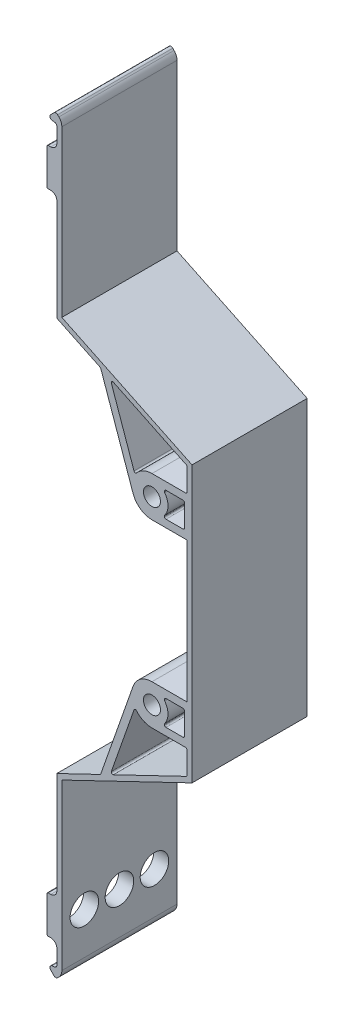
SolidWorks part; units mm, degrees
ref_plane "前视基准面" through (0, 0, 0) normal (0, 0, 1) x (1, 0, 0)
ref_plane "上视基准面" through (0, 0, 0) normal (0, 1, 0) x (1, 0, 0)
ref_plane "右视基准面" through (0, 0, 0) normal (1, 0, 0) x (0, 0, -1)
other "Configuration Table"
sketch "草图1" plane through (0, 0, 0) normal (0, 0, 1) x (1, 0, 0)
  line L2 (95, -72.9584) -> (95, -33.624) construction
  line L4 (95, -72.9584) -> (95, -40)
  line L6 (121, 27.5) -> (95, 40) construction
  line L7 (121, -21.5) -> (121, 21.5)
  line L8 (95, 33.624) -> (95, 72.9584) construction
  line L9 (95, 40) -> (95, 72.9584)
  line L10 (121, -21.5) -> (121, 21.5) construction
  line L11 (94.5667, -39.0987) -> (120, -26.8712)
  line L12 (120, -26.8712) -> (120, 26.8712)
  line L13 (121, 0) -> (102.4527, 0) construction
  line L14 (94.5667, -39.0987) -> (94, -39.3712)
  line L16 (93.5609, -73.0408) -> (93.0647, -73.1018)
  line L17 (74.3726, -94.4142) -> (94.4142, -74.3726) construction
  line L18 (94.4142, -74.3726) -> (94.1572, -74.6296)
  line L19 (93.4501, -74.6296) -> (92.772, -73.9516)
  line L20 (93.4501, 74.6296) -> (92.772, 73.9516)
  line L21 (94.4142, 74.3726) -> (94.1572, 74.6296)
  line L22 (93.5609, 73.0408) -> (93.0647, 73.1018)
  line L23 (94, 39.3712) -> (94, 72.5446)
  line L24 (94.5667, 39.0987) -> (94, 39.3712)
  line L25 (120, 26.8712) -> (94.5667, 39.0987)
  line L26 (113, 14) -> (120, 14)
  line L27 (95, 72.9584) -> (95, 40)
  line L28 (121, -27.5) -> (121, 27.5) construction
  line L29 (95, -40) -> (121, -27.5) construction
  line L30 (121, 27.5) -> (95, 40)
  line L31 (121, -27.5) -> (121, 27.5)
  line L32 (95, -40) -> (121, -27.5)
  line L33 (94, -39.3712) -> (94, -72.5446)
  line L34 (113, 22) -> (120, 22)
  line L35 (109.2253, 16.6764) -> (102.741, 35.1688)
  line L36 (109.6076, 20.1194) -> (104.6528, 34.2496)
  line L37 (104.1849, 35.5842) -> (104.1565, 35.6651)
  line L38 (110.6408, 17.1728) -> (104.1565, 35.6651) construction
  line L39 (113, -22) -> (120, -22)
  line L40 (113, -14) -> (120, -14)
  line L41 (109.6076, -20.1194) -> (104.6528, -34.2496)
  line L42 (109.2253, -16.6764) -> (102.741, -35.1688)
  circle A0 centre (113, 18) radius 4
  arc A1 (94.4142, -74.3726) -> (95, -72.9584) centre (93, -72.9584) ccw construction
  arc A2 (94.4142, -74.3726) -> (95, -72.9584) centre (93, -72.9584) ccw
  arc A3 (94, -72.5446) -> (93.5609, -73.0408) centre (93.5, -72.5446) cw
  arc A4 (94.1572, -74.6296) -> (93.4501, -74.6296) centre (93.8036, -74.2761) cw
  arc A5 (93.0647, -73.1018) -> (92.772, -73.9516) centre (93.1256, -73.598) ccw
  arc A6 (93.0647, 73.1018) -> (92.772, 73.9516) centre (93.1256, 73.598) cw
  arc A7 (94.1572, 74.6296) -> (93.4501, 74.6296) centre (93.8036, 74.2761) ccw
  arc A8 (94, 72.5446) -> (93.5609, 73.0408) centre (93.5, 72.5446) ccw
  arc A9 (94.4142, 74.3726) -> (95, 72.9584) centre (93, 72.9584) cw
  circle A10 centre (113, -18) radius 1.7
  circle A11 centre (113, 18) radius 1.6 construction
  circle A13 centre (113, -18) radius 4
  circle A15 centre (113, 18) radius 1.7
  point P27 (94, -72.9869)
  point P30 (93.8036, -74.9832)
  point P50 (120, 0)
  point P51 (121, 0)
  point P53 (93.8036, 74.9832)
  point P54 (94, 72.9869)
  point P68 (111.7455, 24.7121)
  point P71 (104.3844, 28.1446)
  dimension "D4" = 8
  dimension "D8" = 0.5
  dimension "D9" = 0.5
  dimension "D11" = 3.4
  dimension "D2" = 1
  dimension "D3" = 1
  dimension "D5" = 45
  dimension "D6" = 33.1734
  dimension "D7" = 1.5
extrude "凸台-拉伸1" add sketch "草图1" along normal blind 23
sketch "草图2" plane through (0, 0, 23) normal (0, 0, 1) x (1, 0, 0)
  line L0 (121, 0) -> (0, 0) construction
  line L5 (113, 18) -> (121, 18) construction
  line L6 (121, -27.5) -> (121, 27.5) construction
  line L7 (113, 14) -> (120, 14) construction
  line L8 (115.5, 15.5) -> (119.5, 15.5)
  line L9 (115.5, 15.5) -> (115.5, 20.5)
  line L10 (115.5, 20.5) -> (119.5, 20.5)
  line L11 (119.5, 15.5) -> (119.5, 20.5)
  line L12 (115.5, 15.5) -> (119.5, 20.5) construction
  line L13 (115.5, 20.5) -> (119.5, 15.5) construction
  line L14 (115.5, -20.5) -> (119.5, -15.5) construction
  line L15 (115.5, -15.5) -> (119.5, -20.5) construction
  line L16 (113, -18) -> (121, -18) construction
  line L17 (119.5, -15.5) -> (119.5, -20.5)
  line L18 (115.5, -20.5) -> (119.5, -20.5)
  line L19 (115.5, -15.5) -> (115.5, -20.5)
  line L20 (115.5, -15.5) -> (119.5, -15.5)
  circle A0 centre (113, 18) radius 1.7 construction
  circle A1 centre (113, -18) radius 3.2
  circle A2 centre (113, 18) radius 3.2
  circle A3 centre (113, 18) radius 3.2
  point P4 (117.5, 18)
  point P27 (117.5, -18)
  dimension "D1" = 1.5
  dimension "D2" = 1.5
  dimension "D3" = 1.5
  dimension "D4" = 2.5
extrude "切除-拉伸1" cut sketch "草图2" against normal up to surface (23 mm away) contours A3 L9 L8 L11 L10 | L19 A1 L18 L17 L20
fillet "圆角6" radius 0.3 22 edges at (119.5, -15.5, 11.5) (115.5, -20.5, 11.5) (115.5, -16.0025, 11.5) (115.5, -19.9975, 11.5) (115.5, -15.5, 11.5) (119.5, -20.5, 11.5) (109.6076, -20.1194, 11.5) (104.6528, -34.2496, 11.5) (120, -22, 11.5) (120, -26.8712, 11.5) (115.5, 19.9975, 11.5) (115.5, 16.0025, 11.5) (115.5, 20.5, 11.5) (119.5, 15.5, 11.5) (115.5, 15.5, 11.5) (119.5, 20.5, 11.5) (120, 22, 11.5) (109.6076, 20.1194, 11.5) (120, 26.8712, 11.5) (104.6528, 34.2496, 11.5) (102.741, -35.1688, 11.5) (102.741, 35.1688, 11.5)
sketch "草图3" plane through (95, 0, 0) normal (1, 0, 0) x (0, 0, -1)
  line L0 (-11.5, 22.1215) -> (-11.5, -20.8785) construction
  line L1 (-23, -21.5) -> (0, -21.5) construction
  line L2 (-11.5, -21.5) -> (-11.5, -11.2317) construction
  line L3 (-23, -74.6296) -> (0, -74.6296) construction
  circle A0 centre (-4.5, -64.6296) radius 2.85
  circle A1 centre (-11.5, -64.6296) radius 2.85
  circle A2 centre (-18.5, -64.6296) radius 2.85
  dimension "D1" = 5.7
  dimension "D2" = 14
  dimension "D3" = 10
extrude "切除-拉伸2" cut sketch "草图3" against normal blind 10
sketch "草图4" plane through (94, 0, 0) normal (-1, 0, 0) x (0, 0, 1)
  line L0 (11.5, -64.6296) -> (23, -64.6296) construction
  line L1 (23, -39.3712) -> (23, -72.5446) construction
  line L2 (0, -39.3712) -> (0, -72.5446) construction
  line L3 (23, -68.3796) -> (0, -68.3796)
  line L4 (23, -68.3796) -> (23, -60.8796)
  line L5 (23, -60.8796) -> (0, -60.8796)
  line L6 (0, -68.3796) -> (0, -60.8796)
  circle A0 centre (18.5, -64.6296) radius 2.85 construction
  circle A1 centre (11.5, -64.6296) radius 2.85 construction
  circle A2 centre (4.5, -64.6296) radius 2.85 construction
  circle A3 centre (18.5, -64.6296) radius 2.85
  circle A4 centre (11.5, -64.6296) radius 2.85
  circle A5 centre (4.5, -64.6296) radius 2.85
  dimension "D1" = 7.5
extrude "凸台-拉伸2" add sketch "草图4" along normal blind 2
fillet "圆角2" radius 1.2 2 edges at (94, -60.8796, 11.5) (94, -68.3796, 11.5)
fillet "圆角3" radius 0.3 2 edges at (92, -68.3796, 11.5) (92, -60.8796, 11.5)
mirror "镜向3" about plane through (0, 0, 0) normal (0, 1, 0) of "切除-拉伸2", "凸台-拉伸2"
fillet "圆角4" radius 1.2 2 edges at (94, 60.8796, 11.5) (94, 68.3796, 11.5)
fillet "圆角5" radius 0.3 2 edges at (92, 68.3796, 11.5) (92, 60.8796, 11.5)
sketch "草图5" plane through (95, 0, 0) normal (1, 0, 0) x (0, 0, -1)
  circle A0 centre (-4.5, 64.6296) radius 2.85 construction
  circle A1 centre (-11.5, 64.6296) radius 2.85 construction
  circle A2 centre (-18.5, 64.6296) radius 2.85 construction
  circle A3 centre (-4.5, 64.6296) radius 2.85
  circle A4 centre (-11.5, 64.6296) radius 2.85
  circle A5 centre (-18.5, 64.6296) radius 2.85
extrude "凸台-拉伸3" add sketch "草图5" against normal up to surface (3 mm away)
